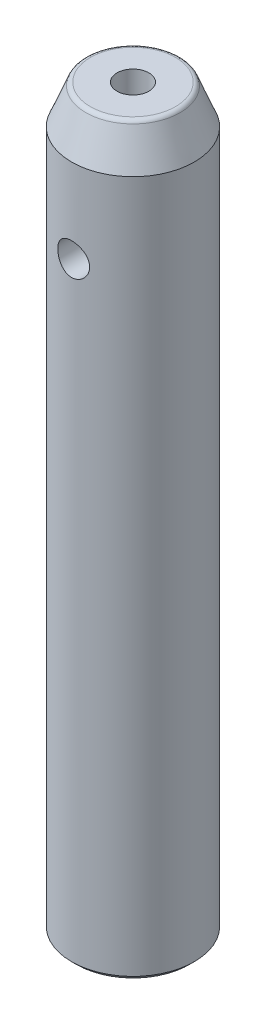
SolidWorks part; units mm, degrees
ref_plane "前基準面" through (0, 0, 0) normal (0, 0, 1) x (1, 0, 0)
ref_plane "上基準面" through (0, 0, 0) normal (0, 1, 0) x (1, 0, 0)
ref_plane "右基準面" through (0, 0, 0) normal (1, 0, 0) x (0, 0, -1)
sketch "草圖1" plane through (0, 0, 0) normal (0, 1, 0) x (1, 0, 0)
  circle A0 centre (0, 0) radius 6.35
  dimension "D1" = 12.7
extrude "填料-伸長1" add sketch "草圖1" along normal blind 76.2
hole_wizard "M4x0.7 螺紋孔1" positions "草圖3" profile "草圖2" tap size "M4x0.7" standard "Ansi Metric"
sketch "草圖3" plane through (0, 76.2, 0) normal (0, 1, 0) x (1, 0, 0)
  point P0 (0, 0)
sketch "草圖2" plane through (0, 76.2, 0) normal (1, 0, 0) x (0, 0, 1)
  line L0 (0, 0) -> (0, 11.0914)
  line L1 (0, 11.0914) -> (1.65, 10.1)
  line L2 (1.65, 10.1) -> (1.65, 0)
  line L5 (1.65, 0) -> (0, 0)
  line L10 (0, 11.0914) -> (-1.65, 10.1) construction
  line L11 (0, -6.35) -> (0, 107.95) construction
  dimension "螺孔鑽直徑" = 3.3
  dimension "螺孔鑽深度" = 10.1
  dimension "導頭角度" = 118
hole_wizard "M6x1.0 螺紋孔1" positions "草圖5" profile "草圖4" tap size "M6x1.0" standard "Ansi Metric"
sketch "草圖5" plane through (0, 0, 0) normal (0, -1, 0) x (-1, 0, 0)
  point P0 (0, 0)
sketch "草圖4" plane through (0, 0, 0) normal (1, 0, 0) x (0, 0, -1)
  line L0 (0, 0) -> (0, 12.5022)
  line L1 (0, 12.5022) -> (2.5, 11)
  line L2 (2.5, 11) -> (2.5, 0)
  line L5 (2.5, 0) -> (0, 0)
  line L10 (0, 12.5022) -> (-2.5, 11) construction
  line L11 (0, -6.35) -> (0, 107.95) construction
  dimension "螺孔鑽直徑" = 5
  dimension "螺孔鑽深度" = 11
  dimension "導頭角度" = 118
chamfer "導角1" distance 4 distance2 1.6 1 edges at (0, 76.2, 6.35)
fillet "圓角1" radius 0.5 1 edges at (0, 76.2, 4.75)
chamfer "導角2" distance 0.5 angle 45 1 edges at (0, 0, 6.35)
ref_plane "平面1" through (0, 0, 6.35) normal (0, 0, 1) x (1, 0, 0)
sketch "草圖6" plane through (0, 0, 6.35) normal (0, 0, 1) x (1, 0, 0)
  line L0 (1.65, 76.2) -> (-1.65, 76.2) construction
  circle A0 centre (0, 63.5) radius 1.65
  dimension "D2" = 3.3
  dimension "D1" = 12.7
extrude "除料-伸長1" cut sketch "草圖6" against normal through all
